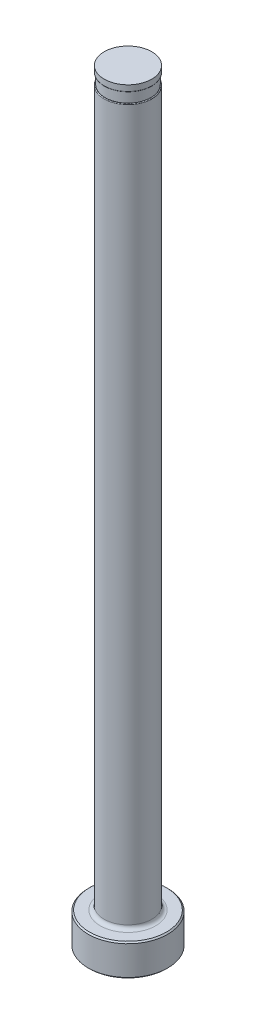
SolidWorks part; units mm, degrees
ref_plane "Front Plane" through (0, 0, 0) normal (0, 0, 1) x (1, 0, 0)
ref_plane "Top Plane" through (0, 0, 0) normal (0, 1, 0) x (1, 0, 0)
ref_plane "Right Plane" through (0, 0, 0) normal (1, 0, 0) x (0, 0, -1)
other "Configuration Table"
sketch "Sketch1" plane through (0, 0, 0) normal (0, 0, 1) x (1, 0, 0)
  line L0 (0, 259.9588) -> (0, -15.1925) construction
  line L1 (0, 0) -> (-7.9375, 0)
  line L2 (-7.9375, 0) -> (-7.9375, 6.35)
  line L3 (-7.9375, 6.35) -> (-4.7625, 6.35)
  line L4 (-4.7625, 6.35) -> (-4.7625, 152.4)
  line L5 (-4.7625, 152.4) -> (0, 152.4)
  line L6 (0, 152.4) -> (0, 0)
  dimension "L" = 152.4
  dimension "H" = 15.875
  dimension "T" = 6.35
  dimension "D" = 9.525
revolve "Revolve1" add sketch "Sketch1" angle 360 about L0
chamfer "Chamfer1" distance 0.254 angle 45 2 edges at (0, 6.35, 7.9375) (0, 0, 7.9375)
fillet "Fillet1" radius 0.762 1 edges at (0, 6.35, 4.7625)
sketch "Sketch2" plane through (0, 0, 0) normal (0, 0, 1) x (1, 0, 0)
  line L0 (-4.7625, 152.4) -> (-4.7625, 7.112) construction
  line L1 (-4.7625, 151.13) -> (-4.5593, 151.13)
  line L2 (-4.7625, 151.13) -> (-4.7625, 149.098)
  line L3 (-4.7625, 149.098) -> (-4.5593, 149.098)
  line L4 (-4.5593, 151.13) -> (-4.5593, 149.098)
  line L5 (4.7625, 152.4) -> (-4.7625, 152.4) construction
  line L6 (0, 153.4483) -> (0, 147.3282) construction
  dimension "D1" = 2.032
  dimension "N" = 1.27
  dimension "FD" = 0.2032
  dimension "D3" = 9.1186
revolve "Vent Relief" cut sketch "Sketch2" angle 360 about L6
sketch "Sketch3" plane through (0, 0, 0) normal (0, 0, 1) x (1, 0, 0)
  line L0 (-4.5593, 150.114) -> (-4.5593, 86.614)
  line L1 (-4.5593, 151.13) -> (-4.5593, 149.098) construction
  line L2 (-4.7625, 149.098) -> (-4.7625, 7.112) construction
  line L3 (-4.7625, 85.4964) -> (-4.7625, 150.114)
  line L4 (-4.7625, 150.114) -> (-4.5593, 150.114)
  arc A0 (-4.5593, 86.614) -> (-4.7625, 85.4964) centre (-7.7343, 86.614) cw
  dimension "D1" = 3.175
  dimension "D2" = 63.5
extrude "D-Slot" cut sketch "Sketch3" against normal through all both and the other way through all
sketch "Sketch5" plane through (0, 0, 0) normal (0, 0, 1) x (1, 0, 0)
  line L0 (-4.7625, 151.13) -> (4.7625, 151.13) construction
  line L1 (-4.7625, 152.4) -> (-4.7498, 152.4)
  line L2 (-4.7625, 152.4) -> (-4.7625, 151.13)
  line L3 (-4.7625, 151.13) -> (-4.7498, 151.13)
  line L4 (-4.7498, 152.4) -> (-4.7498, 151.13)
  line L5 (0, 152.6877) -> (0, 150.5771) construction
  dimension "VP" = 0.0127
revolve "Vent Diameter" cut sketch "Sketch5" angle 360 about L5
fillet "Fillet2" radius 0.127 2 edges at (4.7625, 149.098, 0) (0, 151.13, 4.7498)
sketch "Pocket Sketch" plane through (0, 0, 0) normal (0, 0, 1) x (1, 0, 0)
  line L0 (-8.3344, 0) -> (-8.3344, 6.3754)
  line L1 (-8.3344, 6.3754) -> (-5.7229, 6.3754)
  line L2 (-4.9609, 7.1374) -> (-4.9609, 22.225)
  line L3 (-4.9609, 22.225) -> (0, 22.225)
  line L4 (0, 22.225) -> (0, 0)
  line L5 (0, 0) -> (-8.3344, 0)
  line L6 (0, 12.6104) -> (0, -2.4989) construction
  line L7 (-7.9375, 6.096) -> (-7.9375, 0.254) construction
  line L8 (7.6835, 6.35) -> (-7.6835, 6.35) construction
  line L9 (-4.7625, 85.4964) -> (-4.7625, 7.112) construction
  line L10 (-5.7229, 6.3754) -> (-4.9609, 7.1374)
  point P3 (-4.9609, 6.3754)
  dimension "D1" = 16.6687
  dimension "D2" = 0.3969
  dimension "D3" = 0.0254
  dimension "D4" = 0.1984
  dimension "D5" = 9.9219
  dimension "D6" = 22.225
